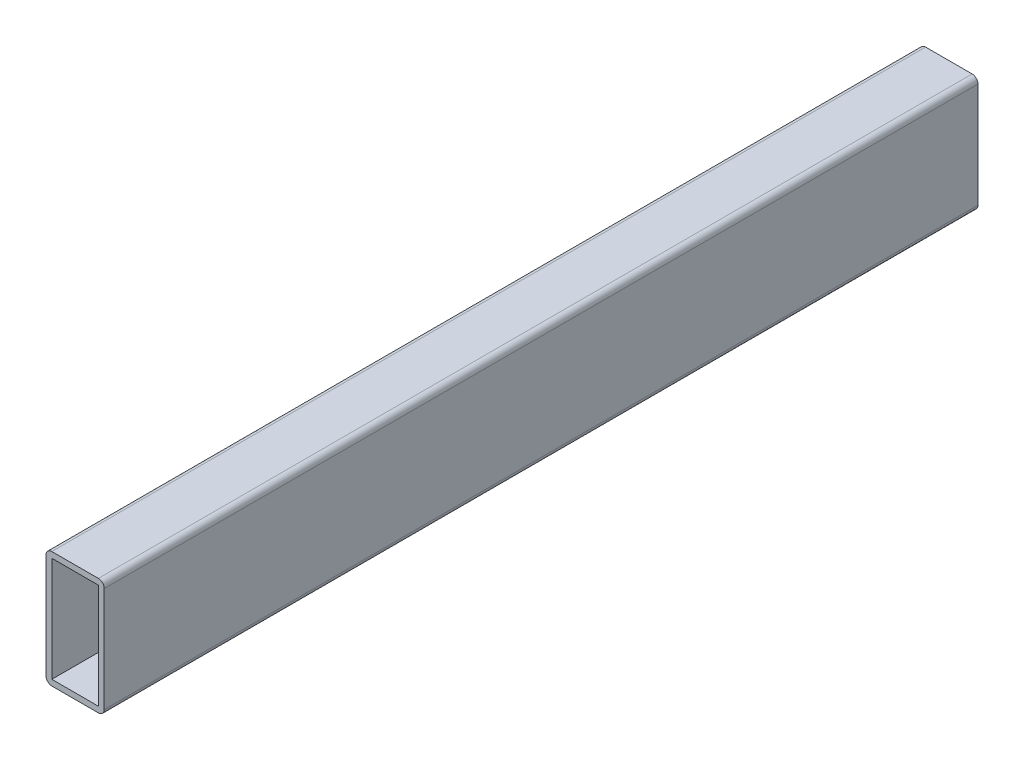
SolidWorks part; units mm, degrees
ref_plane "Спереди" through (0, 0, 0) normal (0, 0, 1) x (1, 0, 0)
ref_plane "Сверху" through (0, 0, 0) normal (0, 1, 0) x (1, 0, 0)
ref_plane "Справа" through (0, 0, 0) normal (1, 0, 0) x (0, 0, -1)
sketch "Эскиз1" plane through (0, 0, 0) normal (0, 0, 1) x (1, 0, 0)
  line L0 (-2, -2) -> (-18, -2)
  line L1 (-2, 0) -> (-18, 0)
  line L2 (0, -2) -> (0, -38)
  line L3 (-2, -40) -> (-18, -40)
  line L4 (-20, -2) -> (-20, -38)
  line L5 (-18, -2) -> (-18, -38)
  line L6 (-2, -38) -> (-18, -38)
  line L7 (-2, -2) -> (-2, -38)
  arc A0 (-18, 0) -> (-20, -2) centre (-18, -2) ccw
  arc A1 (0, -38) -> (-2, -40) centre (-2, -38) cw
  arc A2 (-18, -40) -> (-20, -38) centre (-18, -38) cw
  arc A3 (-2, 0) -> (0, -2) centre (-2, -2) cw
  arc A4 (-18, -2) -> (-18, -2) centre (-18, -2) ccw
  arc A5 (-18, -38) -> (-18, -38) centre (-18, -38) cw
  arc A6 (-2, -38) -> (-2, -38) centre (-2, -38) cw
  arc A7 (-2, -2) -> (-2, -2) centre (-2, -2) cw
  point P7 (-20, 0)
  point P10 (0, -40)
  point P15 (0, 0)
  dimension "D3" = 2
  dimension "D1" = 20
  dimension "D2" = 40
  dimension "D4" = 2
extrude "Бобышка-Вытянуть1" add sketch "Эскиз1" along normal blind 300
